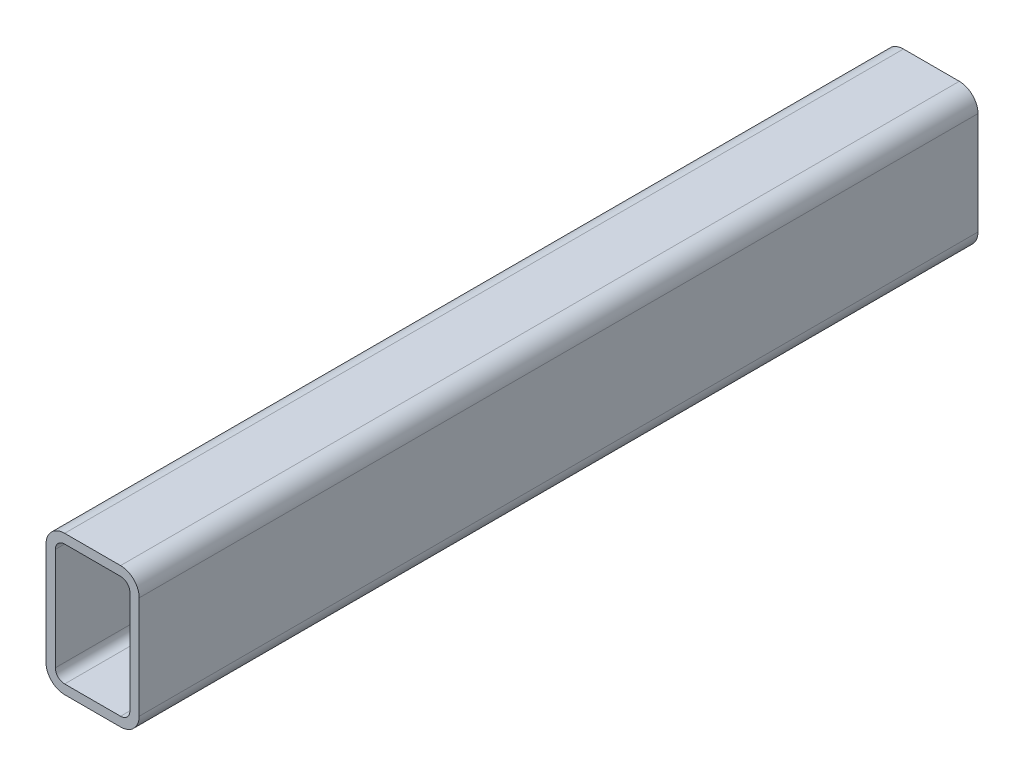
SolidWorks part; units mm, degrees
ref_plane "Plan de face" through (0, 0, 0) normal (0, 0, 1) x (1, 0, 0)
ref_plane "Plan de dessus" through (0, 0, 0) normal (0, 1, 0) x (1, 0, 0)
ref_plane "Plan de droite" through (0, 0, 0) normal (1, 0, 0) x (0, 0, -1)
sketch "Esquisse1" plane through (0, 0, 0) normal (0, 0, 1) x (1, 0, 0)
  line L0 (20, 0) -> (80, 0)
  line L1 (100, 20) -> (100, 130)
  line L2 (80, 150) -> (20, 150)
  line L3 (0, 130) -> (0, 20)
  line L4 (80, 140) -> (20, 140)
  line L5 (10, 130) -> (10, 20)
  line L6 (20, 10) -> (80, 10)
  line L7 (90, 20) -> (90, 130)
  arc A0 (80, 0) -> (100, 20) centre (80, 20) ccw
  arc A1 (100, 130) -> (80, 150) centre (80, 130) ccw
  arc A2 (20, 150) -> (0, 130) centre (20, 130) ccw
  arc A3 (0, 20) -> (20, 0) centre (20, 20) ccw
  arc A4 (20, 140) -> (10, 130) centre (20, 130) ccw
  arc A5 (10, 20) -> (20, 10) centre (20, 20) ccw
  arc A6 (80, 10) -> (90, 20) centre (80, 20) ccw
  arc A7 (90, 130) -> (80, 140) centre (80, 130) ccw
  dimension "D3" = 20
  dimension "D1" = 100
  dimension "D2" = 150
  dimension "D4" = 10
extrude "Extrusion1" add sketch "Esquisse1" along normal mid plane 900
